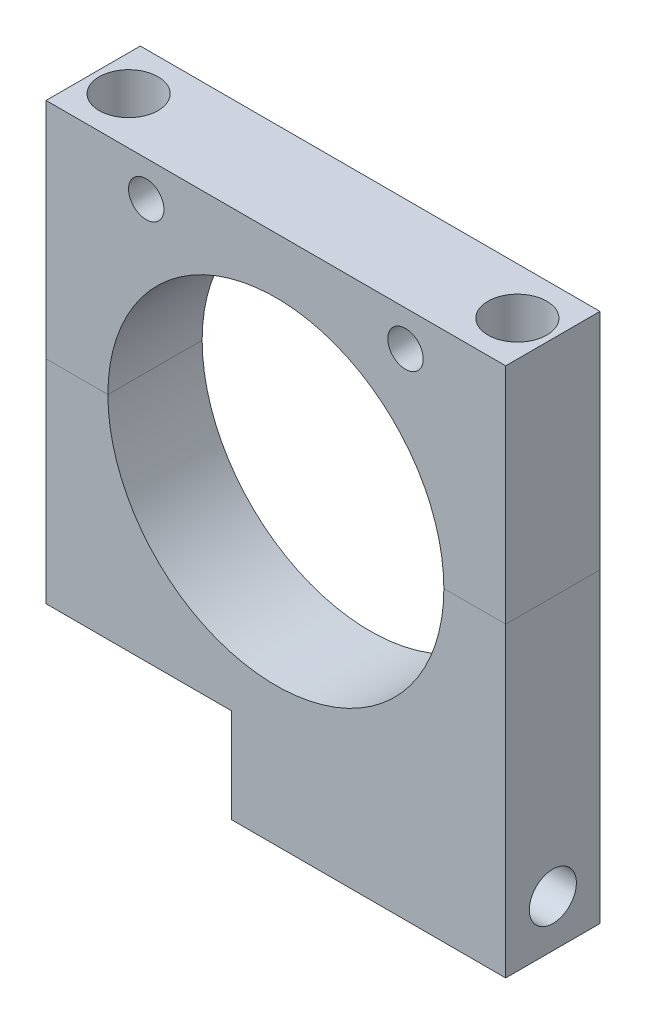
SolidWorks part; units mm, degrees
ref_plane "Front Plane" through (0, 0, 0) normal (0, 0, 1) x (1, 0, 0)
ref_plane "Top Plane" through (0, 0, 0) normal (0, 1, 0) x (1, 0, 0)
ref_plane "Right Plane" through (0, 0, 0) normal (1, 0, 0) x (0, 0, -1)
sketch "Sketch1" plane through (0, 0, 0) normal (0, 0, 1) x (1, 0, 0)
  line L0 (0, 0) -> (22.6314, 0) construction
  line L1 (0, 0) -> (0, 22.6314) construction
  line L2 (22.6314, 0) -> (30.9626, 0)
  line L3 (30.9626, 0) -> (30.9626, 30.1498)
  line L4 (30.9626, 30.1498) -> (-30.9626, 30.1498)
  line L5 (-30.9626, 30.1498) -> (-30.9626, 0)
  line L6 (-30.9626, 0) -> (-22.6314, 0)
  line L7 (30.9626, 0) -> (30.9626, -41.275)
  line L8 (30.9626, -41.275) -> (-30.9626, -41.275)
  line L9 (-30.9626, -41.275) -> (-30.9626, 0)
  line L10 (-26.1874, 0) -> (-26.1874, -41.275)
  line L11 (-26.1874, 0) -> (-26.1874, 30.1498)
  line L12 (26.1874, 0) -> (26.1874, 30.1498)
  line L13 (26.1874, 0) -> (26.1874, -41.275)
  line L14 (-30.9626, -28.575) -> (-5.969, -28.575)
  line L15 (-5.969, -28.575) -> (-5.969, -41.275)
  line L16 (-30.9626, 1.5748) -> (-22.5765, 1.5748)
  line L17 (30.9626, 1.5748) -> (22.5765, 1.5748)
  circle A0 centre (0, 0) radius 22.6314
  circle A1 centre (-17.4625, 25.3746) radius 2.3876
  circle A2 centre (17.4625, 25.3746) radius 2.3876
  dimension "D1" = 45.2628
  dimension "D11" = 4.7752
  dimension "D2" = 30.1498
  dimension "D3" = 41.275
  dimension "D4" = 52.3748
  dimension "D5" = 61.9252
  dimension "D6" = 28.575
  dimension "D7" = 5.969
  dimension "D8" = 4.7752
  dimension "D9" = 3.556
  dimension "D10" = 12.7
  dimension "D12" = 4.7752
  dimension "D13" = 34.925
  dimension "D14" = 1.5748
sketch "Sketch2" plane through (0, 0, 0) normal (0, 0, 1) x (1, 0, 0)
  line L0 (-30.9626, 0) -> (-22.6314, 0) construction
  line L1 (-30.9626, 30.1498) -> (-30.9626, 0) construction
  line L2 (30.9626, 30.1498) -> (-30.9626, 30.1498) construction
  line L3 (30.9626, 0) -> (30.9626, 30.1498) construction
  line L4 (22.6314, 0) -> (30.9626, 0) construction
  line L5 (-30.9626, 0) -> (-22.6314, 0)
  line L6 (-30.9626, 30.1498) -> (-30.9626, 0)
  line L7 (30.9626, 30.1498) -> (-30.9626, 30.1498)
  line L8 (30.9626, 0) -> (30.9626, 30.1498)
  line L9 (22.6314, 0) -> (30.9626, 0)
  circle A0 centre (0, 0) radius 22.6314 construction
  arc A1 (22.6314, 0) -> (-22.6314, 0) centre (0, 0) ccw
extrude "Boss-Extrude1" add sketch "Sketch2" along normal mid plane 12.7
sketch "Sketch3" plane through (0, 0, 0) normal (0, 0, 1) x (1, 0, 0)
  line L0 (-30.9626, 0) -> (-22.6314, 0) construction
  line L1 (-30.9626, -41.275) -> (-30.9626, 0) construction
  line L2 (-30.9626, -28.575) -> (-5.969, -28.575) construction
  line L3 (-5.969, -28.575) -> (-5.969, -41.275) construction
  line L4 (30.9626, -41.275) -> (-30.9626, -41.275) construction
  line L5 (30.9626, 0) -> (30.9626, -41.275) construction
  line L6 (22.6314, 0) -> (30.9626, 0) construction
  line L7 (-30.9626, 0) -> (-22.6314, 0)
  line L8 (-30.9626, -28.575) -> (-30.9626, 0)
  line L9 (-30.9626, -28.575) -> (-5.969, -28.575)
  line L10 (-5.969, -28.575) -> (-5.969, -41.275)
  line L11 (30.9626, -41.275) -> (-5.969, -41.275)
  line L12 (30.9626, 0) -> (30.9626, -41.275)
  line L13 (22.6314, 0) -> (30.9626, 0)
  circle A0 centre (0, 0) radius 22.6314 construction
  arc A1 (-22.6314, 0) -> (22.6314, 0) centre (0, 0) ccw
extrude "Boss-Extrude2" add sketch "Sketch3" along normal mid plane 12.7 separate body
sketch "Sketch4" plane through (0, 0, 0) normal (0, 1, 0) x (1, 0, 0)
  circle A0 centre (-26.1874, 0) radius 2.3876
  circle A1 centre (-26.1874, 0) radius 3.9624
  circle A2 centre (26.1874, 0) radius 2.3876
  circle A3 centre (26.1874, 0) radius 3.9624
  dimension "D1" = 7.9248
  dimension "D2" = 4.7752
sketch "Sketch5" plane through (0, 0, 0) normal (0, 1, 0) x (1, 0, 0)
  circle A0 centre (-26.1874, 0) radius 2.3876 construction
  circle A1 centre (26.1874, 0) radius 2.3876 construction
  circle A2 centre (-26.1874, 0) radius 2.3876
  circle A3 centre (26.1874, 0) radius 2.3876
extrude "Cut-Extrude1" cut sketch "Sketch5" against normal blind 19.05 and the other way blind 50.8
sketch "Sketch6" plane through (0, 0, 0) normal (0, 1, 0) x (1, 0, 0)
  circle A0 centre (-26.1874, 0) radius 3.9624 construction
  circle A1 centre (26.1874, 0) radius 3.9624 construction
  circle A2 centre (-26.1874, 0) radius 3.9624
  circle A3 centre (26.1874, 0) radius 3.9624
extrude "Cut-Extrude2" cut sketch "Sketch6" along normal blind 25.4 from offset 14.2748
sketch "Sketch7" plane through (0, 0, 0) normal (1, 0, 0) x (0, 0, -1)
  circle A0 centre (0, -34.925) radius 3.175
  dimension "D1" = 6.35
  dimension "D2" = 34.925
extrude "Cut-Extrude3" cut sketch "Sketch7" against normal blind 25.4 and the other way blind 33.02
sketch "Sketch8" plane through (0, 0, 0) normal (0, 0, 1) x (1, 0, 0)
  circle A0 centre (-17.4625, 25.3746) radius 2.3876 construction
  circle A1 centre (17.4625, 25.3746) radius 2.3876 construction
  circle A2 centre (-17.4625, 25.3746) radius 2.3876
  circle A3 centre (17.4625, 25.3746) radius 2.3876
extrude "Cut-Extrude4" cut sketch "Sketch8" against normal mid plane 25.4
sketch "Sketch9" plane through (0, 0, 0) normal (0, 0, 1) x (1, 0, 0)
  line L1 (-30.9626, 1.5748) -> (30.9626, 1.5748)
extrude "Cut-Extrude8" [suppressed] cut sketch "Sketch9" against normal through all and the other way through all flip side to cut
